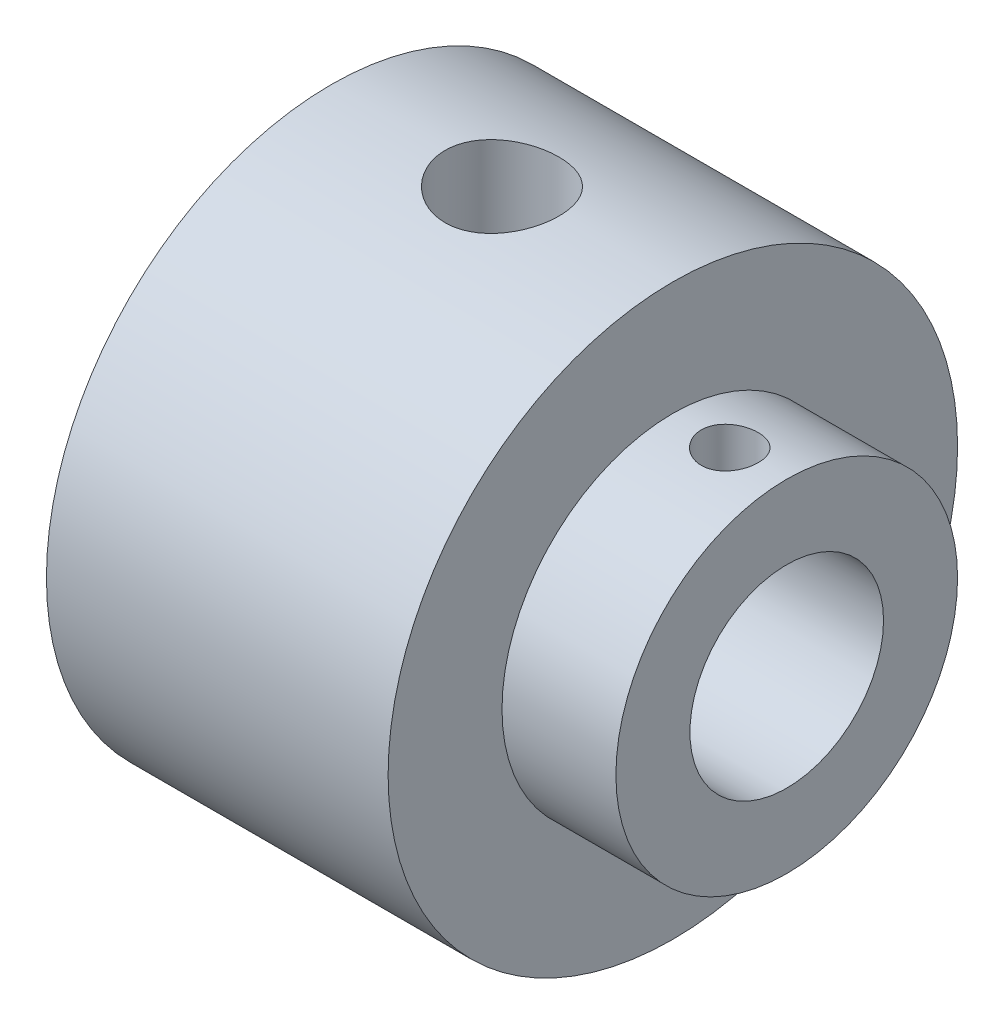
SolidWorks part; units mm, degrees
ref_plane "Front Plane" through (0, 0, 0) normal (0, 0, 1) x (1, 0, 0)
ref_plane "Top Plane" through (0, 0, 0) normal (0, 1, 0) x (1, 0, 0)
ref_plane "Right Plane" through (0, 0, 0) normal (1, 0, 0) x (0, 0, -1)
sketch "Sketch1" plane through (0, 0, 0) normal (0, 0, 1) x (1, 0, 0)
  line L0 (0, 0) -> (40, 0)
  line L1 (0, 0) -> (0, 25)
  line L2 (0, 25) -> (30, 25)
  line L3 (30, 25) -> (30, 15)
  line L4 (30, 15) -> (40, 15)
  line L5 (40, 15) -> (40, 0)
  dimension "D1" = 25
  dimension "D2" = 15
  dimension "D3" = 40
  dimension "D4" = 10
revolve "Revolve1" add sketch "Sketch1" angle 360 about L0
sketch "Sketch2" plane through (40, 0, 0) normal (1, 0, 0) x (0, 0, -1)
  circle A0 centre (0, 0) radius 8.5
  dimension "D1" = 17
extrude "Extrude1" cut sketch "Sketch2" against normal through all
ref_plane "Plane1" through (0, 25, 0) normal (0, 1, 0) x (-1, 0, 0)
sketch "Sketch3" plane through (0, 25, 0) normal (0, 1, 0) x (-1, 0, 0)
  line L0 (0, 25) -> (-30, 25) construction
  line L1 (-30, 25) -> (-30, -25) construction
  circle A0 centre (-15, 0) radius 5
  dimension "D1" = 10
  dimension "D2" = 25
  dimension "D3" = 15
extrude "Extrude2" cut sketch "Sketch3" against normal blind 25
ref_plane "Plane2" through (0, 15, 0) normal (0, 1, 0) x (-1, 0, 0)
sketch "Sketch4" plane through (0, 15, 0) normal (0, 1, 0) x (-1, 0, 0)
  line L0 (-40, 15) -> (-40, -15) construction
  line L1 (-30, 15) -> (-40, 15) construction
  point P1 (-35, 0)
  dimension "D1" = 5
  dimension "D2" = 15
hole_wizard "M6 Tapped Hole2" positions "3DSketch1" profile "Sketch5" tap size "M6" standard "ISO"
sketch3d "3DSketch1"
  point P0 (35, 15, 0)
  point P4 (35, 15, 0)
sketch "Sketch5" plane through (35, 15, 0) normal (1, 0, 0) x (0, 0, 1)
  line L0 (0, 0) -> (0, 15)
  line L1 (0, 15) -> (2.5, 15)
  line L2 (2.5, 15) -> (2.5, 0)
  line L5 (2.5, 0) -> (0, 0)
  line L11 (0, -6.35) -> (0, 107.95) construction
  dimension "Thru Tap Drill Dia." = 5
  dimension "Thru Tap Drill Depth" = 15
